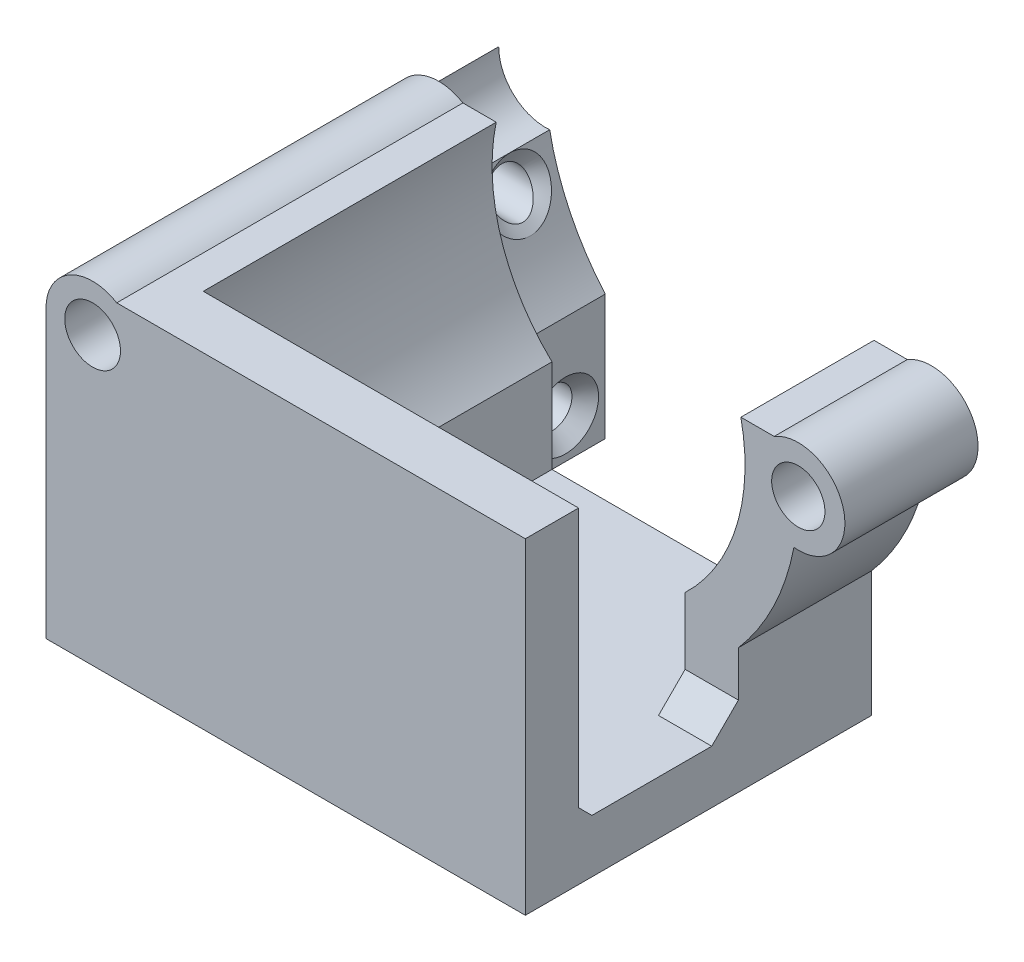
SolidWorks part; units mm, degrees
ref_plane "Спереди" through (0, 0, 0) normal (0, 0, 1) x (1, 0, 0)
ref_plane "Сверху" through (0, 0, 0) normal (0, 1, 0) x (1, 0, 0)
ref_plane "Справа" through (0, 0, 0) normal (1, 0, 0) x (0, 0, -1)
sketch "Sketch1" plane through (0, 0, 0) normal (0, 0, 1) x (1, 0, 0)
  line L0 (0, 0) -> (10, 0)
  line L1 (10, 0) -> (10, 7)
  line L2 (14.1875, 20.4941) -> (16.6875, 20.4941)
  line L3 (-45.9471, 17.5) -> (45.9471, 17.5) construction
  line L4 (0, -4) -> (14, -4)
  line L5 (14, -4) -> (14, 5.4066)
  line L6 (0, 0) -> (0, 49.7966) construction
  line L7 (-14, -4) -> (-14, 5.4066)
  line L8 (0, -4) -> (-2.184, -4) construction
  line L9 (0, 0) -> (-2.184, 0) construction
  line L10 (0, -4) -> (-14, -4)
  line L11 (-14.1875, 20.4941) -> (-16.6875, 20.4941)
  line L12 (-10, 0) -> (-10, 7)
  line L13 (0, 0) -> (-10, 0)
  arc A0 (10, 7) -> (14.1875, 20.4941) centre (0, 17.5) ccw
  arc A1 (14, 5.4066) -> (18.1689, 14.0157) centre (0, 17.5) ccw
  arc A2 (10, 7) -> (14.1875, 20.4941) centre (0, 17.5) ccw construction
  arc A3 (18.1689, 14.0157) -> (16.6875, 20.4941) centre (18.5, 17.5) ccw
  arc A4 (14, 5.4066) -> (18.1013, 21.3201) centre (0, 17.5) ccw construction
  circle A5 centre (18.5, 17.5) radius 2
  circle A6 centre (-18.5, 17.5) radius 2
  arc A7 (-18.1689, 14.0157) -> (-16.6875, 20.4941) centre (-18.5, 17.5) cw
  arc A8 (-14, 5.4066) -> (-18.1689, 14.0157) centre (0, 17.5) cw
  arc A9 (-10, 7) -> (-14.1875, 20.4941) centre (0, 17.5) cw
  dimension "D1" = 7
  dimension "D3" = 4
  dimension "D4" = 14.5
  dimension "D2" = 10
  dimension "D5" = 7
  dimension "D6" = 4
  dimension "D7" = 2.5
extrude "Boss-Extrude1" add sketch "Sketch1" along normal blind 10
sketch "Sketch3" plane through (0, 0, 10) normal (0, 0, 1) x (1, 0, 0)
  line L0 (10, 0) -> (14, 0)
  line L1 (14, -4) -> (14, 5.4066) construction
  line L2 (14, 0) -> (14, -4)
  line L8 (10, 7) -> (10, 0)
  line L9 (10, 0) -> (-10, 0)
  line L10 (-10, 0) -> (-10, 7)
  line L11 (-14.1875, 20.4941) -> (-16.6875, 20.4941)
  line L12 (-14, 5.4066) -> (-14, -4)
  line L13 (-14, -4) -> (14, -4)
  line L14 (14, -4) -> (14, 5.4066)
  line L15 (16.6875, 20.4941) -> (14.1875, 20.4941)
  line L17 (10, 0) -> (-10, 0)
  line L18 (-10, 0) -> (-10, 7)
  line L19 (-14.1875, 20.4941) -> (-16.6875, 20.4941)
  line L20 (-14, 5.4066) -> (-14, -4)
  line L21 (-14, -4) -> (14, -4)
  circle A0 centre (-18.5, 17.5) radius 2.0929
  arc A6 (-14.1875, 20.4941) -> (-10, 7) centre (0, 17.5) ccw
  arc A7 (-16.6875, 20.4941) -> (-18.1689, 14.0157) centre (-18.5, 17.5) ccw
  arc A8 (-18.1689, 14.0157) -> (-14, 5.4066) centre (0, 17.5) ccw
  arc A9 (14, 5.4066) -> (18.1689, 14.0157) centre (0, 17.5) ccw
  arc A10 (18.1689, 14.0157) -> (16.6875, 20.4941) centre (18.5, 17.5) ccw
  arc A11 (10, 7) -> (14.1875, 20.4941) centre (0, 17.5) ccw
  arc A12 (-14.1875, 20.4941) -> (-10, 7) centre (0, 17.5) ccw
  arc A13 (-16.6875, 20.4941) -> (-18.1689, 14.0157) centre (-18.5, 17.5) ccw
  arc A14 (-18.1689, 14.0157) -> (-14, 5.4066) centre (0, 17.5) ccw
  dimension "D1" = 0
extrude "Boss-Extrude2" add sketch "Sketch3" along normal blind 12
sketch "Sketch4" plane through (0, 0, 22) normal (0, 0, 1) x (1, 0, 0)
  line L1 (-14.1875, 20.4941) -> (14, 20.4941)
  line L2 (14, 20.4941) -> (14, 0)
  line L6 (14, 0) -> (-10, 0)
  line L7 (-10, 0) -> (-10, 7)
  line L8 (-14.1875, 20.4941) -> (-16.6875, 20.4941)
  line L9 (-14, 5.4066) -> (-14, -4)
  line L10 (-14, -4) -> (14, -4)
  line L11 (14, -4) -> (14, 0)
  line L14 (-14.1875, 20.4941) -> (-16.6875, 20.4941)
  line L15 (-14, 5.4066) -> (-14, -4)
  line L16 (-14, -4) -> (14, -4)
  line L18 (14, -4) -> (14, 0)
  circle A0 centre (-18.5, 17.5) radius 2.0929
  arc A3 (-14.1875, 20.4941) -> (-10, 7) centre (0, 17.5) ccw
  arc A4 (-16.6875, 20.4941) -> (-18.1689, 14.0157) centre (-18.5, 17.5) ccw
  arc A5 (-18.1689, 14.0157) -> (-14, 5.4066) centre (0, 17.5) ccw
  arc A7 (-16.6875, 20.4941) -> (-18.1689, 14.0157) centre (-18.5, 17.5) ccw
  arc A8 (-18.1689, 14.0157) -> (-14, 5.4066) centre (0, 17.5) ccw
  dimension "D1" = 0
extrude "Boss-Extrude3" add sketch "Sketch4" along normal blind 4
sketch "Sketch5" plane through (0, 0, 26) normal (0, 0, 1) x (1, 0, 0)
  line L0 (-22, 17.5) -> (-22, -4)
  line L1 (-22, -4) -> (-14, -4)
  line L4 (14, 20.4941) -> (-16.6875, 20.4941)
  line L5 (-14, 5.4066) -> (-14, -4)
  line L6 (-14, -4) -> (14, -4)
  line L7 (14, -4) -> (14, 20.4941)
  line L9 (-14, 5.4066) -> (-14, -4)
  arc A2 (-16.6875, 20.4941) -> (-18.1689, 14.0157) centre (-18.5, 17.5) ccw
  arc A3 (-18.1689, 14.0157) -> (-14, 5.4066) centre (0, 17.5) ccw
  arc A4 (-22, 17.5) -> (-18.1689, 14.0157) centre (-18.5, 17.5) ccw
  arc A5 (-18.1689, 14.0157) -> (-14, 5.4066) centre (0, 17.5) ccw
  dimension "D1" = 0
extrude "Boss-Extrude4" add sketch "Sketch5" against normal through all
sketch "Sketch6" plane through (-10, 0, 0) normal (1, 0, 0) x (0, 0, -1)
  line L0 (-22, 0) -> (0, 0) construction
  line L2 (-22, 0) -> (-22, 20.4941) construction
  circle A0 centre (-19, 3) radius 1.5
  point P2 (-11, 0)
  dimension "D2" = 3
  dimension "D1" = 3
  dimension "D3" = 3
extrude "Cut-Extrude1" cut sketch "Sketch6" against normal through all
chamfer "Chamfer1" distance 1.5 angle 45 1 edges at (-10, 3, 17.5)
chamfer "Chamfer2" distance 2 angle 45 1 edges
chamfer "Chamfer4" distance 1 angle 45 1 edges
sketch "Sketch7" plane through (0, 0, 0) normal (0, 0, -1) x (-1, 0, 0)
  line L3 (14, 5.4066) -> (14, -4)
  line L4 (14, -4) -> (22, -4)
  line L5 (22, -4) -> (22, 17.5)
  line L6 (14, 5.4066) -> (14, -4)
  line L7 (14, -4) -> (22, -4)
  line L8 (22, -4) -> (22, 17.5)
  arc A2 (18.1689, 14.0157) -> (22, 17.5) centre (18.5, 17.5) ccw
  arc A3 (14, 5.4066) -> (18.1689, 14.0157) centre (0, 17.5) ccw
  arc A4 (18.1689, 14.0157) -> (22, 17.5) centre (18.5, 17.5) ccw
  arc A5 (14, 5.4066) -> (18.1689, 14.0157) centre (0, 17.5) ccw
  dimension "D1" = 0
extrude "Boss-Extrude5" add sketch "Sketch7" along normal blind 8
sketch "Sketch8" plane through (-22, 0, 0) normal (-1, 0, 0) x (0, 0, 1)
  line L0 (-8, -4) -> (-8, 17.5) construction
  line L2 (-8, 17.5) -> (0, 17.5) construction
  line L3 (-8, -4) -> (26, -4) construction
  circle A0 centre (-5, 11.5) radius 1.5
  circle A1 centre (-5, -1) radius 1.5
  dimension "D1" = 3
  dimension "D2" = 3
  dimension "D3" = 3
  dimension "D4" = 6
  dimension "D5" = 3
extrude "Cut-Extrude2" cut sketch "Sketch8" against normal through all
chamfer "Chamfer5" distance 1 angle 45 2 edges at (-14, 0.5, -5) (-17.6219, 11.868, -6.4542)
